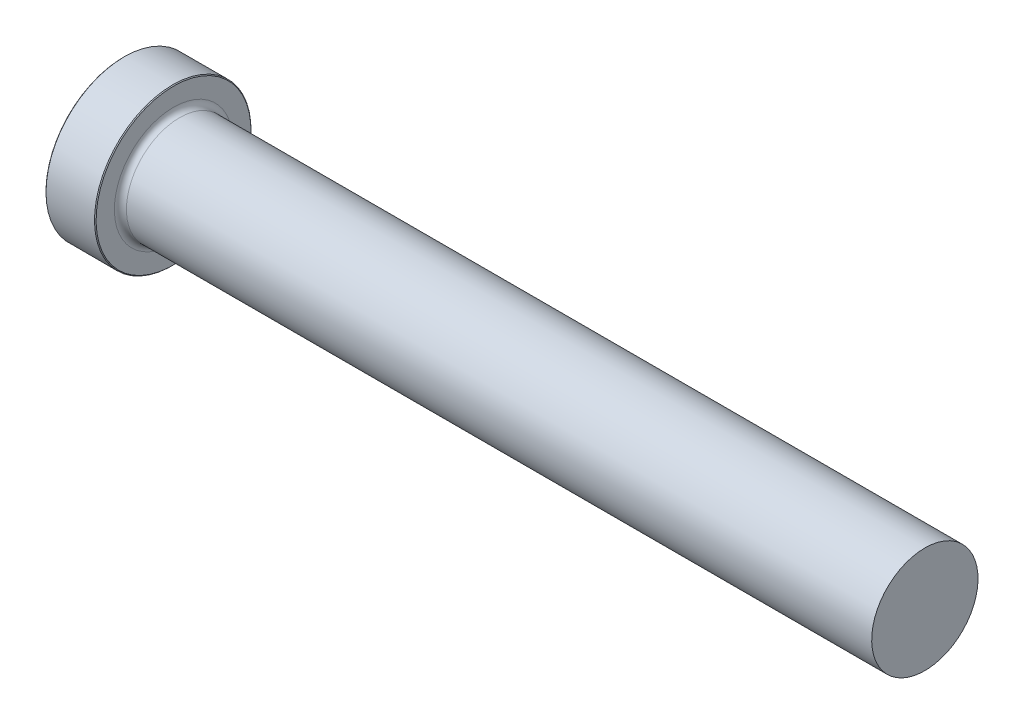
SolidWorks part; units mm, degrees
ref_plane "Front Plane" through (0, 0, 0) normal (0, 0, 1) x (1, 0, 0)
ref_plane "Top Plane" through (0, 0, 0) normal (0, 1, 0) x (1, 0, 0)
ref_plane "Right Plane" through (0, 0, 0) normal (1, 0, 0) x (0, 0, -1)
sketch "Sketch1" plane through (0, 0, 0) normal (0, 0, 1) x (1, 0, 0)
  line L0 (0, 0) -> (0, 9.9219)
  line L1 (0, 9.9219) -> (6.35, 9.9219)
  line L2 (6.35, 9.9219) -> (6.35, 7.5025)
  line L3 (7.112, 6.7405) -> (101.6, 6.7405)
  line L4 (101.6, 6.7405) -> (101.6, 0)
  line L5 (101.6, 0) -> (0, 0)
  line L6 (101.6, 0) -> (101.6, -6.7405) construction
  line L7 (101.6, -6.7405) -> (6.35, -6.7405) construction
  line L8 (0, 0) -> (0, -9.9219) construction
  line L9 (0, -9.9219) -> (6.35, -9.9219) construction
  line L10 (6.35, -9.9219) -> (6.35, -6.7405) construction
  arc A0 (6.35, 7.5025) -> (7.112, 6.7405) centre (7.112, 7.5025) ccw
  dimension "D4" = 0.762
  dimension "L" = 101.6
  dimension "D" = 13.4811
  dimension "H" = 19.8438
  dimension "T" = 6.35
revolve "Revolve1" add sketch "Sketch1" angle 360 about L5
chamfer "Chamfer1" distance 0.1016 angle 45 2 edges at (0, 9.9219, 0) (6.35, 9.9219, 0)
